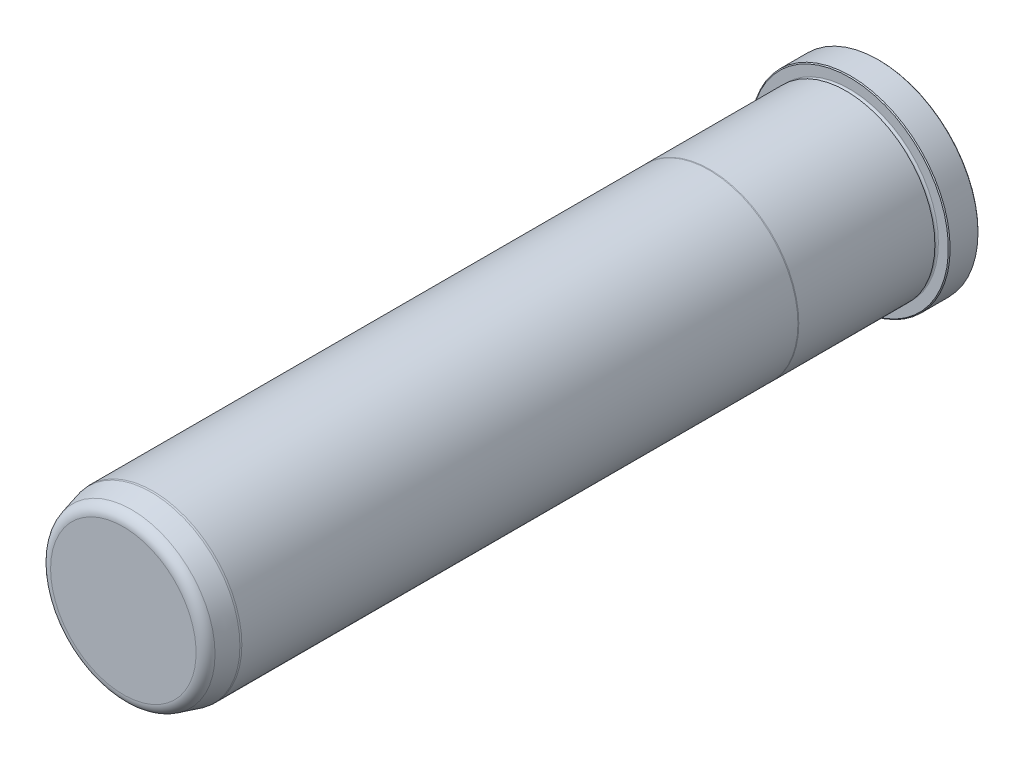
SolidWorks part; units mm, degrees
ref_plane "Front Plane" through (0, 0, 0) normal (0, 0, 1) x (1, 0, 0)
ref_plane "Top Plane" through (0, 0, 0) normal (0, 1, 0) x (1, 0, 0)
ref_plane "Right Plane" through (0, 0, 0) normal (1, 0, 0) x (0, 0, -1)
sketch "Sketch1" plane through (0, 0, 0) normal (1, 0, 0) x (0, 0, -1)
  line L0 (0, 0) -> (0, 42.7355)
  line L1 (0, 42.7355) -> (-12.7, 42.7355)
  line L2 (-12.7, 42.7355) -> (-12.7, 38.0873)
  line L3 (-7.9248, 37.3253) -> (-9.4488, 37.3253) construction
  line L4 (-14.224, 38.0873) -> (-14.224, 38.1127)
  line L5 (-14.224, 38.1127) -> (-72.5348, 38.1127)
  line L6 (-72.5348, 38.1127) -> (-72.898, 38.0873)
  line L7 (-72.898, 38.0873) -> (-311.15, 38.0873)
  line L9 (-323.85, 34.8219) -> (-323.85, 0)
  line L10 (-323.85, 0) -> (0, 0)
  line L11 (0, 0) -> (13.6287, 0) construction
  line L12 (-311.15, 38.0873) -> (-311.912, 38.0206)
  line L13 (-311.912, 38.0206) -> (-323.85, 34.8219)
  arc A0 (-14.224, 38.0873) -> (-12.7, 38.0873) centre (-13.462, 38.0873) ccw
  dimension "D14" = 1.524
  dimension "D1" = 12.7
  dimension "D2" = 1.524
  dimension "D3" = 85.471
  dimension "D4" = 76.2254
  dimension "D5" = 72.898
  dimension "D6" = 323.85
  dimension "D7" = 0.7874
  dimension "D8" = 4
  dimension "D9" = 76.1746
  dimension "D10" = 5
  dimension "D11" = 15
  dimension "D12" = 0.762
  dimension "D13" = 12.7
revolve "Revolve1" add sketch "Sketch1" angle 360 about L11
fillet "Fillet6" radius 4.7625 1 edges at (34.8219, 0, 323.85)
chamfer "Chamfer1" distance 0.381 angle 45 2 edges at (42.7355, 0, 0) (42.7355, 0, 12.7)
